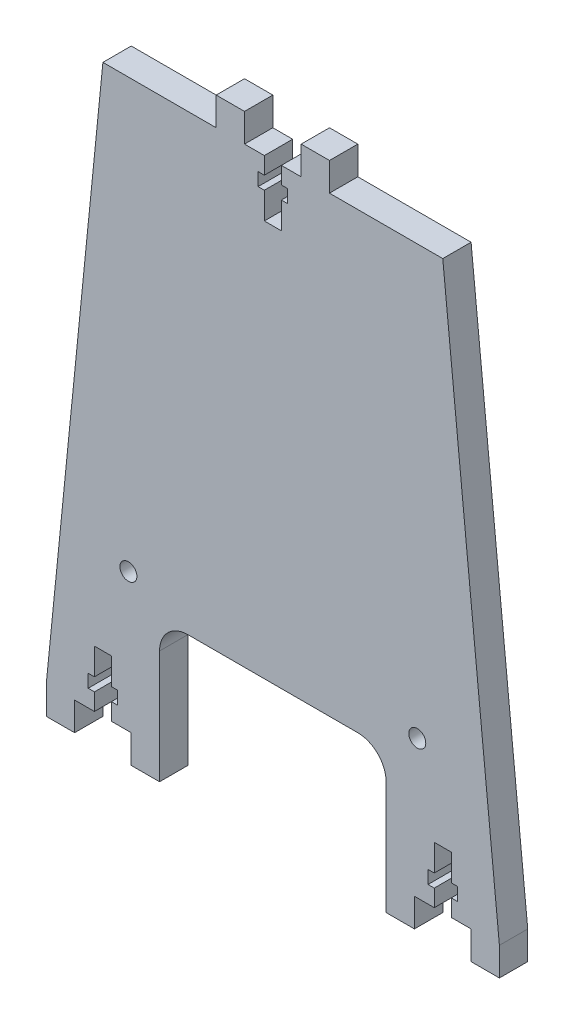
SolidWorks part; units mm, degrees
ref_plane "Front Plane" through (0, 0, 0) normal (0, 0, 1) x (1, 0, 0)
ref_plane "Top Plane" through (0, 0, 0) normal (0, 1, 0) x (1, 0, 0)
ref_plane "Right Plane" through (0, 0, 0) normal (1, 0, 0) x (0, 0, -1)
sketch "Sketch1" plane through (0, 0, 0) normal (0, 0, 1) x (1, 0, 0)
  line L19 (60, 0) -> (0, 0) construction
  line L20 (0, 0) -> (0, 100) construction
  line L21 (0, 100) -> (60, 100) construction
  line L22 (60, 100) -> (60, 0) construction
  line L24 (30, 0) -> (30, 20) construction
  line L25 (0, 0) -> (0, 100) construction
  line L26 (0, 100) -> (20, 100)
  line L28 (40, 100) -> (60, 100)
  line L29 (60, 100) -> (60, 0) construction
  line L41 (-10, 0) -> (0, 100)
  line L53 (70, 0) -> (60, 100)
  line L54 (30, 100) -> (30, 78.7792) construction
  line L55 (31.5, 100) -> (35, 100)
  line L56 (35, 105) -> (40, 105)
  line L57 (40, 105) -> (40, 100)
  line L58 (35, 105) -> (35, 100)
  line L59 (28.5, 100) -> (25, 100)
  line L60 (25, 100) -> (25, 105)
  line L61 (25, 105) -> (20, 105)
  line L62 (20, 105) -> (20, 100)
  line L63 (31.5, 100) -> (28.5, 100) construction
  line L64 (28.5, 100) -> (28.5, 97)
  line L65 (28.5, 94.7) -> (27.4, 94.7)
  line L66 (32.6, 97) -> (32.6, 94.7)
  line L67 (27.4, 97) -> (28.5, 97)
  line L68 (28.5, 94.7) -> (28.5, 90)
  line L69 (28.5, 90) -> (31.5, 90)
  line L70 (31.5, 90) -> (31.5, 94.7)
  line L71 (31.5, 97) -> (32.6, 97)
  line L72 (27.4, 94.7) -> (27.4, 97)
  line L73 (32.6, 94.7) -> (31.5, 94.7)
  line L74 (31.5, 97) -> (31.5, 100)
  line L75 (30, 90) -> (30, 100) construction
  line L76 (10, 0) -> (10, 20)
  line L77 (10, 20) -> (50, 20)
  line L78 (50, 20) -> (50, 0)
  line L79 (60, 0) -> (60, 11.2208) construction
  line L80 (58.5, 0) -> (55, 0)
  line L81 (55, -5) -> (50, -5)
  line L82 (50, -5) -> (50, 0)
  line L83 (55, -5) -> (55, 0)
  line L84 (61.5, 0) -> (65, 0)
  line L85 (65, 0) -> (65, -5)
  line L86 (65, -5) -> (70, -5)
  line L87 (70, -5) -> (70, 0)
  line L88 (58.5, 0) -> (61.5, 0) construction
  line L89 (61.5, 0) -> (61.5, 3)
  line L90 (61.5, 5.3) -> (62.6, 5.3)
  line L91 (57.4, 3) -> (57.4, 5.3)
  line L92 (62.6, 3) -> (61.5, 3)
  line L93 (61.5, 5.3) -> (61.5, 10)
  line L94 (61.5, 10) -> (58.5, 10)
  line L95 (58.5, 10) -> (58.5, 5.3)
  line L96 (58.5, 3) -> (57.4, 3)
  line L97 (62.6, 5.3) -> (62.6, 3)
  line L98 (57.4, 5.3) -> (58.5, 5.3)
  line L99 (58.5, 3) -> (58.5, 0)
  line L100 (60, 10) -> (60, 0) construction
  line L101 (0, 0) -> (0, 11.2208) construction
  line L102 (-1.5, 0) -> (-5, 0)
  line L103 (-5, -5) -> (-10, -5)
  line L104 (-10, -5) -> (-10, 0)
  line L105 (-5, -5) -> (-5, 0)
  line L106 (1.5, 0) -> (5, 0)
  line L107 (5, 0) -> (5, -5)
  line L108 (5, -5) -> (10, -5)
  line L109 (10, -5) -> (10, 0)
  line L110 (-1.5, 0) -> (1.5, 0) construction
  line L111 (1.5, 0) -> (1.5, 3)
  line L112 (1.5, 5.3) -> (2.6, 5.3)
  line L113 (-2.6, 3) -> (-2.6, 5.3)
  line L114 (2.6, 3) -> (1.5, 3)
  line L115 (1.5, 5.3) -> (1.5, 10)
  line L116 (1.5, 10) -> (-1.5, 10)
  line L117 (-1.5, 10) -> (-1.5, 5.3)
  line L118 (-1.5, 3) -> (-2.6, 3)
  line L119 (2.6, 5.3) -> (2.6, 3)
  line L120 (-2.6, 5.3) -> (-1.5, 5.3)
  line L121 (-1.5, 3) -> (-1.5, 0)
  line L122 (0, 10) -> (0, 0) construction
  circle A4 centre (55.5, 24.4) radius 1.5
  circle A5 centre (4.5, 24.4) radius 1.5
  point P6 (30, 10)
  dimension "D9" = 5
  dimension "D10" = 3
  dimension "D3" = 100
  dimension "D4" = 60
  dimension "D5" = 30
  dimension "D6" = 30
  dimension "D7" = 20
  dimension "D8" = 10
  dimension "D11" = 51
  dimension "D12" = 5
  dimension "D13" = 5.2
  dimension "D14" = 3
  dimension "D15" = 10
  dimension "D16" = 5
  dimension "D17" = 5
  dimension "D18" = 5.2
  dimension "D19" = 3
  dimension "D20" = 2.3
  dimension "D21" = 3
  dimension "D22" = 10
  dimension "D23" = 24.4
  dimension "D24" = 2.3
  dimension "D25" = 3
  dimension "D26" = 10
  dimension "D27" = 10
  dimension "D28" = 5
  dimension "D29" = 5
  dimension "D30" = 5.2
  dimension "D31" = 3
  dimension "D32" = 2.3
  dimension "D33" = 3
  dimension "D34" = 10
  dimension "D35" = 40
extrude "Boss-Extrude1" add sketch "Sketch1" along normal blind 5
fillet "Fillet1" radius 5 2 edges at (50, 20, 2.5) (10, 20, 2.5)
